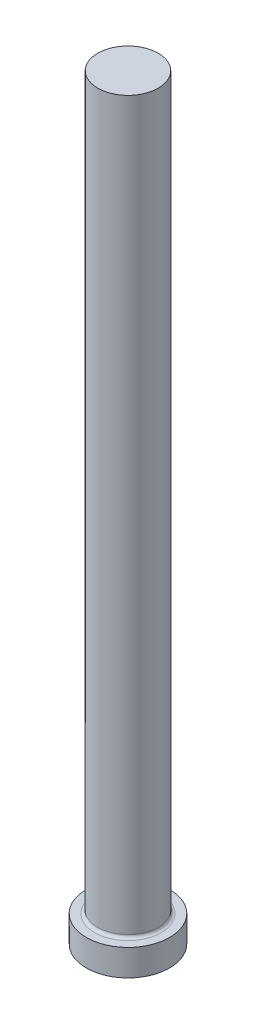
SolidWorks part; units mm, degrees
ref_plane "Plano frontal" through (0, 0, 0) normal (0, 0, 1) x (1, 0, 0)
ref_plane "Plano superior" through (0, 0, 0) normal (0, 1, 0) x (1, 0, 0)
ref_plane "Plano direito" through (0, 0, 0) normal (1, 0, 0) x (0, 0, -1)
sketch "Esboço1" plane through (0, 0, 0) normal (0, 0, 1) x (1, 0, 0)
  line L0 (0, 0) -> (11, 0)
  line L1 (11, 0) -> (11, 7)
  line L2 (11, 7) -> (8.8, 7)
  line L3 (8, 7.8) -> (8, 200)
  line L4 (8, 200) -> (0, 200)
  line L5 (0, 200) -> (0, 0) construction
  line L6 (0, 0) -> (0, 200)
  arc A0 (8.8, 7) -> (8, 7.8) centre (8.8, 7.8) cw
  dimension "D3" = 0.8
  dimension "D1" = 22
  dimension "D2" = 16
  dimension "D4" = 7
  dimension "D5" = 200
revolve "Revolução1" add sketch "Esboço1" angle 360 about L5
sketch "Esboço2"
  dimension "D1" = 0.825
  dimension "D2" = 1.925
  dimension "D3" = 1.2375
  dimension "D4" = 5.9125
wrap "Envolver1" sketch "Esboço2" wrap type deboss source sketch "Esboço2" thickness 0.1 parameters "D1"=0.1
